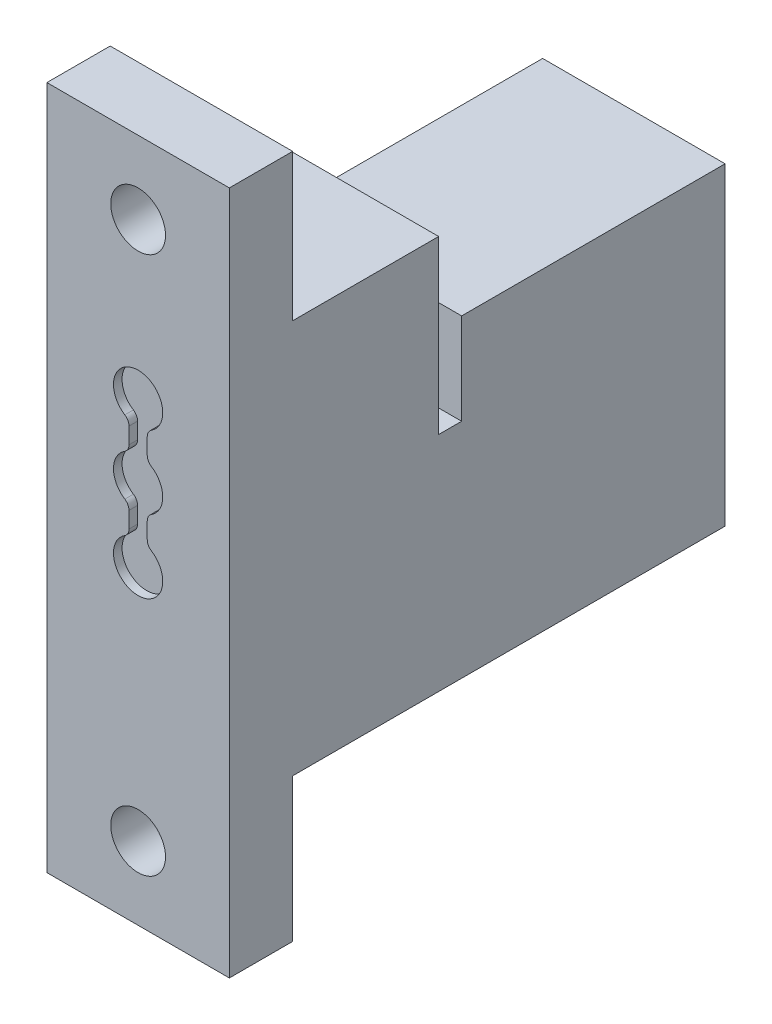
SolidWorks part; units mm, degrees
ref_plane "Front Plane" through (0, 0, 0) normal (0, 0, 1) x (1, 0, 0)
ref_plane "Top Plane" through (0, 0, 0) normal (0, 1, 0) x (1, 0, 0)
ref_plane "Right Plane" through (0, 0, 0) normal (1, 0, 0) x (0, 0, -1)
sketch "Sketch1" plane through (0, 0, 0) normal (0, 0, 1) x (1, 0, 0)
  line L0 (0, 8) -> (0, 0) construction
  line L1 (0.5, 6.4436) -> (0.5, 5.5564)
  line L2 (0.5, 2.4436) -> (0.5, 1.5564)
  line L3 (-0.5, 6.4436) -> (-0.5, 5.5564)
  line L4 (-0.5, 2.4436) -> (-0.5, 1.5564)
  line L5 (0, -14.9435) -> (0, 14.9435) construction
  line L7 (-5, 20.5) -> (-5, -17) construction
  line L8 (-5, -17) -> (5, -17) construction
  line L9 (-5, 20.5) -> (5, 20.5)
  line L10 (-5, 20.5) -> (-5, -17)
  line L11 (-5, -17) -> (5, -17)
  line L12 (5, 20.5) -> (5, -17) construction
  line L13 (5, 20.5) -> (5, -17)
  circle A0 centre (0, 0) radius 0.75
  circle A1 centre (0, 4) radius 0.75
  circle A2 centre (0, 8) radius 0.75
  arc A3 (0.7297, 6.8642) -> (-0.7297, 6.8642) centre (0, 8) ccw
  arc A4 (-0.7297, 5.1358) -> (-0.7297, 2.8642) centre (0, 4) ccw
  arc A5 (-0.7297, 1.1358) -> (0.7297, 1.1358) centre (0, 0) ccw
  arc A6 (0.7297, 2.8642) -> (0.7297, 5.1358) centre (0, 4) ccw
  arc A7 (0.5, 6.4436) -> (0.7297, 6.8642) centre (1, 6.4436) cw
  arc A8 (0.7297, 5.1358) -> (0.5, 5.5564) centre (1, 5.5564) cw
  arc A9 (0.5, 2.4436) -> (0.7297, 2.8642) centre (1, 2.4436) cw
  arc A10 (0.7297, 1.1358) -> (0.5, 1.5564) centre (1, 1.5564) cw
  arc A11 (-0.5, 1.5564) -> (-0.7297, 1.1358) centre (-1, 1.5564) cw
  arc A12 (-0.7297, 2.8642) -> (-0.5, 2.4436) centre (-1, 2.4436) cw
  arc A13 (-0.5, 5.5564) -> (-0.7297, 5.1358) centre (-1, 5.5564) cw
  arc A14 (-0.7297, 6.8642) -> (-0.5, 6.4436) centre (-1, 6.4436) cw
  circle A15 centre (0, 16.5) radius 1.5 construction
  circle A16 centre (0, -13) radius 1.5 construction
  point P21 (0, 21)
  point P38 (0, 0)
  point P39 (0, 20.5)
  point P40 (0, 0)
  point P41 (0, 0)
  point P42 (0, 0)
  point P43 (0, 0)
  point P46 (0, 0)
  point P47 (0, 0)
  point P48 (0, 0)
  point P49 (0, 0)
  point P50 (0, 0)
  point P51 (8.0948, -12.4)
  point P52 (0, 0)
  dimension "D3" = 0.5
  dimension "D5" = 0.5
  dimension "D6" = 0.5
  dimension "D7" = 0.5
  dimension "D8" = 0.5
  dimension "D12" = 16.5
  dimension "D13" = 2.7
  dimension "D14" = 1.5
  dimension "D15" = 3
  dimension "D16" = 4
  dimension "D2" = 17
  dimension "D4" = 0.5
  dimension "D9" = 10
  dimension "D10" = 12.5
  dimension "D11" = 21
  dimension "D17" = 4
sketch "Sketch6" plane through (0, 0, 0) normal (0, 0, 1) x (1, 0, 0)
  line L0 (-5, 20.5) -> (5, 20.5)
  line L1 (-5, 20.5) -> (-5, -17)
  line L2 (-5, -17) -> (5, -17)
  line L3 (5, 20.5) -> (5, -17)
  line L4 (-5, 20.5) -> (5, 20.5) construction
  line L5 (-5, -17) -> (5, -17) construction
  line L6 (5, 20.5) -> (5, -17) construction
  line L7 (-5, 20.5) -> (-5, -17) construction
extrude "Extrude1" add sketch "Sketch6" against normal blind 3.47
sketch "Sketch9" plane through (0, 0, 0) normal (0, 0, 1) x (1, 0, 0)
  line L2 (0, -1.9085) -> (0, 1.9085) construction
  circle A0 centre (0, 16.5) radius 1.5
  circle A1 centre (0, -13) radius 1.5
  circle A2 centre (0, 16.5) radius 1.5 construction
  circle A3 centre (0, -13) radius 1.5 construction
  point P4 (0, 18.7403)
extrude "Cut-Extrude1" cut sketch "Sketch9" against normal blind 3.47
sketch "Sketch15" plane through (0, 0, -3.47) normal (0, 0, -1) x (-1, 0, 0)
  line L0 (-5, -17) -> (-5, 20.5) construction
  line L1 (-5, 12.46) -> (5, 12.46)
  line L2 (-5, 12.46) -> (-5, -9.14)
  line L3 (-5, -9.14) -> (5, -9.14)
  line L4 (5, 12.46) -> (5, -9.14)
  line L5 (5, 20.5) -> (5, -17) construction
  line L6 (5, -17) -> (-5, -17) construction
  dimension "D1" = 21.6
  dimension "D2" = 7.86
extrude "Extrude2" add sketch "Sketch15" along normal blind 8
sketch "Sketch16" plane through (0, 0, -11.47) normal (0, 0, -1) x (-1, 0, 0)
  line L0 (-5, 12.46) -> (-5, -9.14) construction
  line L1 (-5, 8.06) -> (5, 8.06)
  line L2 (-5, 8.06) -> (-5, -9.14)
  line L3 (-5, -9.14) -> (5, -9.14)
  line L4 (5, 8.06) -> (5, -9.14)
  dimension "D1" = 17.2
extrude "Extrude3" add sketch "Sketch16" along normal blind 15.7
sketch "Sketch17" plane through (0, 8.06, 0) normal (0, 1, 0) x (-1, 0, 0)
  line L0 (5, -27.17) -> (5, -11.47) construction
  line L1 (5, -12.73) -> (-5, -12.73)
  line L2 (5, -12.73) -> (5, -11.47)
  line L3 (5, -11.47) -> (-5, -11.47)
  line L4 (-5, -12.73) -> (-5, -11.47)
  dimension "D1" = 1.26
extrude "Cut-Extrude3" cut sketch "Sketch17" against normal blind 5
sketch "Sketch19" plane through (0, 0, 0) normal (0, 0, 1) x (1, 0, 0)
  line L0 (0, 20.5) -> (0, -17) construction
  line L1 (5, 20.5) -> (-5, 20.5) construction
  line L2 (-5, -17) -> (5, -17) construction
  line L3 (-0.5, 6.4436) -> (-0.5, 5.5564) construction
  line L4 (-0.5, 2.4436) -> (-0.5, 1.5564) construction
  line L5 (0.5, 2.4436) -> (0.5, 1.5564) construction
  line L6 (0.5, 6.4436) -> (0.5, 5.5564) construction
  line L7 (-0.5, 6.4436) -> (-0.5, 5.5564)
  line L8 (-0.5, 2.4436) -> (-0.5, 1.5564)
  line L9 (0.5, 2.4436) -> (0.5, 1.5564)
  line L10 (0.5, 6.4436) -> (0.5, 5.5564)
  arc A0 (0.7297, 6.8642) -> (-0.7297, 6.8642) centre (0, 8) ccw construction
  arc A1 (-0.5, 6.4436) -> (-0.7297, 6.8642) centre (-1, 6.4436) ccw construction
  arc A2 (-0.7297, 5.1358) -> (-0.5, 5.5564) centre (-1, 5.5564) ccw construction
  arc A3 (-0.7297, 5.1358) -> (-0.7297, 2.8642) centre (0, 4) ccw construction
  arc A4 (-0.5, 2.4436) -> (-0.7297, 2.8642) centre (-1, 2.4436) ccw construction
  arc A5 (-0.7297, 1.1358) -> (-0.5, 1.5564) centre (-1, 1.5564) ccw construction
  arc A7 (-0.7297, 1.1358) -> (0.7297, 1.1358) centre (0, 0) ccw construction
  arc A8 (0.5, 1.5564) -> (0.7297, 1.1358) centre (1, 1.5564) ccw construction
  arc A9 (0.7297, 2.8642) -> (0.5, 2.4436) centre (1, 2.4436) ccw construction
  arc A10 (0.7297, 2.8642) -> (0.7297, 5.1358) centre (0, 4) ccw construction
  arc A11 (0.5, 5.5564) -> (0.7297, 5.1358) centre (1, 5.5564) ccw construction
  arc A12 (0.7297, 6.8642) -> (0.5, 6.4436) centre (1, 6.4436) ccw construction
  arc A13 (0.7297, 6.8642) -> (-0.7297, 6.8642) centre (0, 8) ccw
  arc A14 (-0.5, 6.4436) -> (-0.7297, 6.8642) centre (-1, 6.4436) ccw
  arc A15 (-0.7297, 5.1358) -> (-0.5, 5.5564) centre (-1, 5.5564) ccw
  arc A16 (-0.7297, 5.1358) -> (-0.7297, 2.8642) centre (0, 4) ccw
  arc A17 (-0.5, 2.4436) -> (-0.7297, 2.8642) centre (-1, 2.4436) ccw
  arc A18 (-0.7297, 1.1358) -> (-0.5, 1.5564) centre (-1, 1.5564) ccw
  arc A19 (-0.7297, 1.1358) -> (0.7297, 1.1358) centre (0, 0) ccw
  arc A20 (0.5, 1.5564) -> (0.7297, 1.1358) centre (1, 1.5564) ccw
  arc A21 (0.7297, 2.8642) -> (0.5, 2.4436) centre (1, 2.4436) ccw
  arc A22 (0.7297, 2.8642) -> (0.7297, 5.1358) centre (0, 4) ccw
  arc A23 (0.5, 5.5564) -> (0.7297, 5.1358) centre (1, 5.5564) ccw
  arc A24 (0.7297, 6.8642) -> (0.5, 6.4436) centre (1, 6.4436) ccw
extrude "Cut-Extrude4" cut sketch "Sketch19" against normal blind 0.47
sketch "Sketch20" plane through (0, 0, 0) normal (0, 0, 1) x (1, 0, 0)
  line L0 (0, -13) -> (0, 16.5) construction
  line L4 (-5, 20.5) -> (-5, -17)
  line L5 (-5, -17) -> (5, -17)
  line L6 (5, -17) -> (5, 20.5)
  line L7 (5, 20.5) -> (-5, 20.5)
  line L8 (-5, 20.5) -> (-5, -17) construction
  line L9 (-5, -17) -> (5, -17) construction
  line L10 (5, -17) -> (5, 20.5) construction
  line L11 (5, 20.5) -> (-5, 20.5) construction
  line L12 (-0.5, 6.4436) -> (-0.5, 5.5564)
  line L13 (-0.5, 6.4436) -> (-0.5, 5.5564)
  line L14 (-0.5, 2.4436) -> (-0.5, 1.5564)
  line L15 (-0.5, 2.4436) -> (-0.5, 1.5564)
  line L21 (0.5, 1.5564) -> (0.5, 2.4436)
  line L22 (0.5, 1.5564) -> (0.5, 2.4436)
  line L23 (0.5, 5.5564) -> (0.5, 6.4436)
  line L24 (0.5, 5.5564) -> (0.5, 6.4436)
  circle A0 centre (0, -13) radius 1.5 construction
  circle A1 centre (0, 16.5) radius 1.5 construction
  circle A2 centre (0, -13) radius 1.5 construction
  circle A3 centre (0, 16.5) radius 1.5 construction
  arc A12 (0.7297, 6.8642) -> (0.5, 6.4436) centre (1, 6.4436) ccw
  arc A13 (0.7297, 6.8642) -> (0.5, 6.4436) centre (1, 6.4436) ccw
  arc A14 (0.7297, 6.8642) -> (-0.7297, 6.8642) centre (0, 8) ccw
  arc A15 (0.7297, 6.8642) -> (-0.7297, 6.8642) centre (0, 8) ccw
  arc A16 (-0.5, 6.4436) -> (-0.7297, 6.8642) centre (-1, 6.4436) ccw
  arc A17 (-0.5, 6.4436) -> (-0.7297, 6.8642) centre (-1, 6.4436) ccw
  arc A18 (-0.7297, 5.1358) -> (-0.5, 5.5564) centre (-1, 5.5564) ccw
  arc A19 (-0.7297, 5.1358) -> (-0.5, 5.5564) centre (-1, 5.5564) ccw
  arc A20 (-0.7297, 5.1358) -> (-0.7297, 2.8642) centre (0, 4) ccw
  arc A21 (-0.7297, 5.1358) -> (-0.7297, 2.8642) centre (0, 4) ccw
  arc A22 (-0.5, 2.4436) -> (-0.7297, 2.8642) centre (-1, 2.4436) ccw
  arc A23 (-0.5, 2.4436) -> (-0.7297, 2.8642) centre (-1, 2.4436) ccw
  arc A40 (-0.7297, 1.1358) -> (-0.5, 1.5564) centre (-1, 1.5564) ccw
  arc A41 (-0.7297, 1.1358) -> (-0.5, 1.5564) centre (-1, 1.5564) ccw
  arc A42 (-0.7297, 1.1358) -> (0.7297, 1.1358) centre (0, 0) ccw
  arc A43 (-0.7297, 1.1358) -> (0.7297, 1.1358) centre (0, 0) ccw
  arc A44 (0.5, 1.5564) -> (0.7297, 1.1358) centre (1, 1.5564) ccw
  arc A45 (0.5, 1.5564) -> (0.7297, 1.1358) centre (1, 1.5564) ccw
  arc A46 (0.7297, 2.8642) -> (0.5, 2.4436) centre (1, 2.4436) ccw
  arc A47 (0.7297, 2.8642) -> (0.5, 2.4436) centre (1, 2.4436) ccw
  arc A48 (0.7297, 2.8642) -> (0.7297, 5.1358) centre (0, 4) ccw
  arc A49 (0.7297, 2.8642) -> (0.7297, 5.1358) centre (0, 4) ccw
  arc A50 (0.5, 5.5564) -> (0.7297, 5.1358) centre (1, 5.5564) ccw
  arc A51 (0.5, 5.5564) -> (0.7297, 5.1358) centre (1, 5.5564) ccw
  point P32 (0, 1.75)
  dimension "D3" = 29.5
  dimension "D1" = 0
  dimension "D2" = 0
